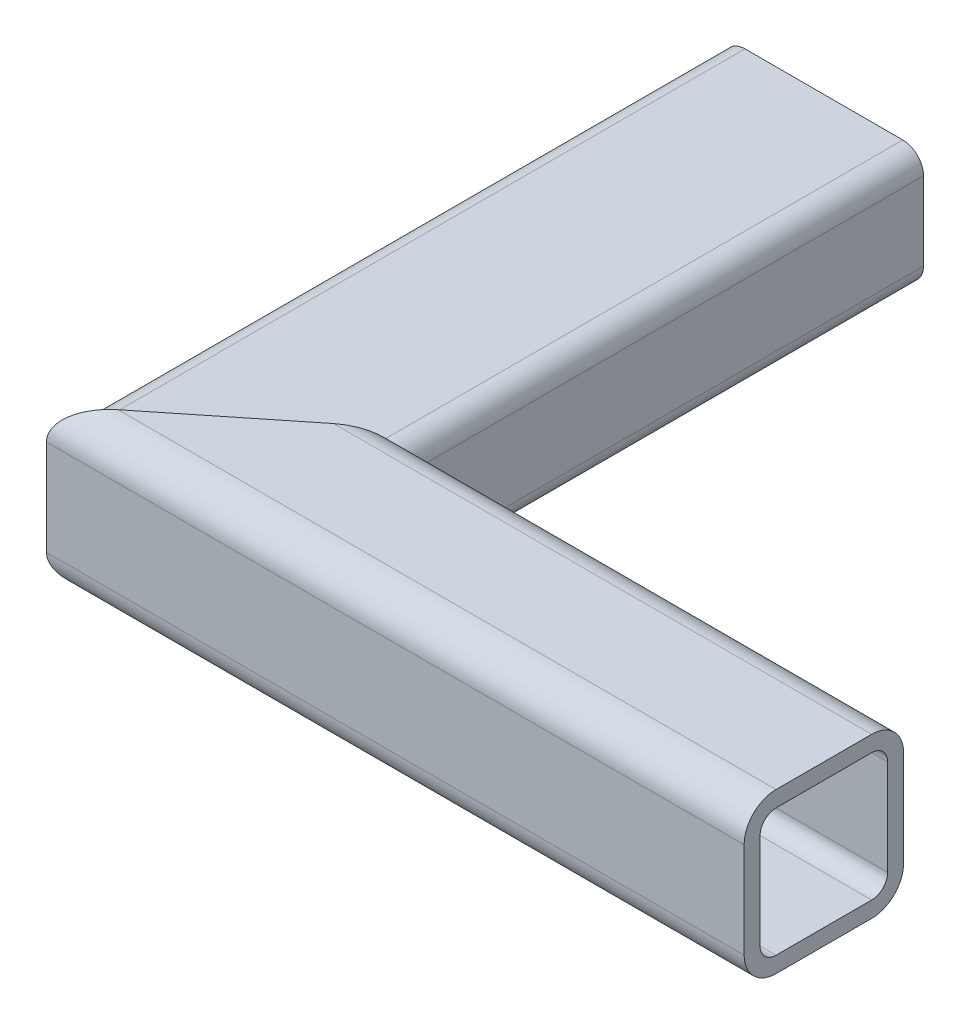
SolidWorks part; units mm, degrees
ref_plane "Front Plane" through (0, 0, 0) normal (0, 0, 1) x (1, 0, 0)
ref_plane "Top Plane" through (0, 0, 0) normal (0, 1, 0) x (1, 0, 0)
ref_plane "Right Plane" through (0, 0, 0) normal (1, 0, 0) x (0, 0, -1)
sketch "Sketch1" plane through (0, 0, 0) normal (0, 1, 0) x (1, 0, 0)
  line L0 (0, 150) -> (0, 0)
  line L1 (0, 0) -> (150, 0)
  dimension "D1" = 150
other "Square tube 40 X 40 X 4(1)"
ref_plane "Plane1" through (0, 0, 0) normal (1, 0, 0) x (0, 0, -1)
sketch "Sketch11" plane through (0, 0, 0) normal (1, 0, 0) x (0, 0, -1)
  line L0 (-12, -16) -> (12, -16)
  line L1 (-16, -12) -> (-16, 12)
  line L2 (12, 16) -> (-12, 16)
  line L3 (16, 12) -> (16, -12)
  line L4 (-12, -20) -> (12, -20)
  line L5 (-20, -12) -> (-20, 12)
  line L6 (12, 20) -> (-12, 20)
  line L7 (20, 12) -> (20, -12)
  arc A0 (20, 12) -> (12, 20) centre (12, 12) ccw
  arc A1 (12, -20) -> (20, -12) centre (12, -12) ccw
  arc A2 (-20, -12) -> (-12, -20) centre (-12, -12) ccw
  arc A3 (-12, 20) -> (-20, 12) centre (-12, 12) ccw
  arc A4 (-12, 16) -> (-16, 12) centre (-12, 12) ccw
  arc A5 (16, 12) -> (12, 16) centre (12, 12) ccw
  arc A6 (12, -16) -> (16, -12) centre (12, -12) ccw
  arc A7 (-16, -12) -> (-12, -16) centre (-12, -12) ccw
  point P0 (-20, 0)
  point P1 (20, 0)
  point P2 (0, 20)
  point P3 (0, -20)
  point P4 (0, 0)
  point P5 (-20, -20)
  point P6 (20, -20)
  point P7 (20, 20)
  point P8 (-20, 20)
  point P33 (0, 0)
  dimension "D1" = 8
  dimension "Thickness" = 4
  dimension "V_leg" = 40
other "Rectangular tube 50 X 30 X 2.6(1)"
ref_plane "Plane2" through (0, 0, -150) normal (0, 0, 1) x (0, 1, 0)
sketch "Sketch14" plane through (0, 0, -150) normal (0, 0, 1) x (0, 1, 0)
  line L0 (-9.8, -22.4) -> (9.8, -22.4)
  line L1 (-12.4, -19.8) -> (-12.4, 19.8)
  line L2 (9.8, 22.4) -> (-9.8, 22.4)
  line L3 (12.4, 19.8) -> (12.4, -19.8)
  line L4 (-9.8, -25) -> (9.8, -25)
  line L5 (-15, -19.8) -> (-15, 19.8)
  line L6 (9.8, 25) -> (-9.8, 25)
  line L7 (15, 19.8) -> (15, -19.8)
  arc A0 (15, 19.8) -> (9.8, 25) centre (9.8, 19.8) ccw
  arc A1 (9.8, -25) -> (15, -19.8) centre (9.8, -19.8) ccw
  arc A2 (-15, -19.8) -> (-9.8, -25) centre (-9.8, -19.8) ccw
  arc A3 (-9.8, 25) -> (-15, 19.8) centre (-9.8, 19.8) ccw
  arc A4 (-9.8, 22.4) -> (-12.4, 19.8) centre (-9.8, 19.8) ccw
  arc A5 (12.4, 19.8) -> (9.8, 22.4) centre (9.8, 19.8) ccw
  arc A6 (9.8, -22.4) -> (12.4, -19.8) centre (9.8, -19.8) ccw
  arc A7 (-12.4, -19.8) -> (-9.8, -22.4) centre (-9.8, -19.8) ccw
  point P0 (0, 25)
  point P1 (15, 0)
  point P2 (0, -25)
  point P3 (-15, 0)
  point P4 (-15, 25)
  point P5 (15, 25)
  point P6 (15, -25)
  point P7 (-15, -25)
  point P8 (0, 0)
  point P33 (0, 0)
  dimension "D1" = 5.2
  dimension "Thickness" = 2.6
  dimension "V_leg" = 50
  dimension "H_leg" = 30
other "Trim/Extend1"
